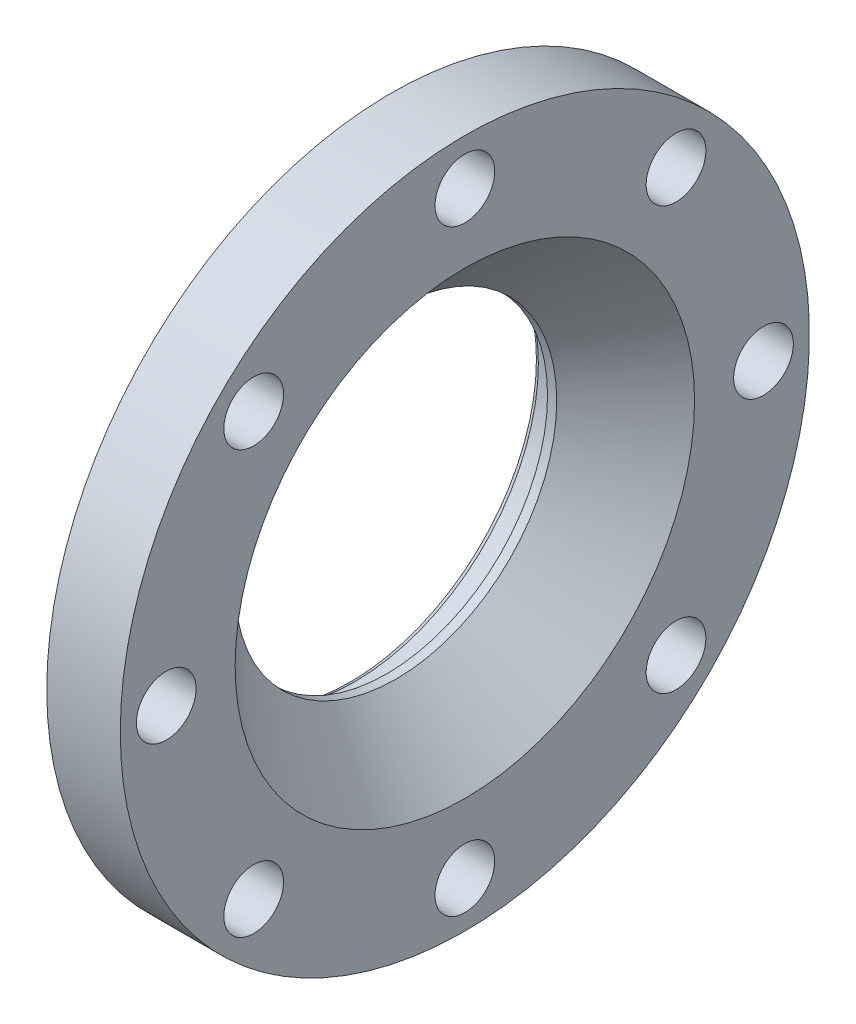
SolidWorks part; units mm, degrees
ref_plane "Plan de face" through (0, 0, 0) normal (0, 0, 1) x (1, 0, 0)
ref_plane "Plan de dessus" through (0, 0, 0) normal (0, 1, 0) x (1, 0, 0)
ref_plane "Plan de droite" through (0, 0, 0) normal (1, 0, 0) x (0, 0, -1)
sketch "Esquisse1" plane through (0, 0, 0) normal (0, 0, 1) x (1, 0, 0)
  line L0 (0, 0) -> (38.5331, 0) construction
  line L1 (0, 47.5) -> (0, 55)
  line L2 (0, 55) -> (3, 55)
  line L3 (3, 55) -> (3, 51.9)
  line L4 (3, 51.9) -> (7.8, 51.9)
  line L5 (7.8, 51.9) -> (7.8, 55)
  line L6 (7.8, 55) -> (12, 55)
  line L7 (12, 55) -> (12, 75)
  line L8 (12, 75) -> (28, 75)
  line L9 (28, 75) -> (28, 50)
  line L10 (28, 50) -> (13, 35)
  line L11 (13, 35) -> (11, 35)
  line L12 (11, 35) -> (11, 40)
  line L13 (11, 40) -> (3, 40)
  line L14 (3, 40) -> (3, 47.5)
  line L15 (3, 47.5) -> (0, 47.5)
  dimension "D1" = 150
  dimension "D2" = 45
  dimension "D3" = 28
  dimension "D4" = 12
  dimension "D5" = 3
  dimension "D6" = 4.8
  dimension "D7" = 3
  dimension "D8" = 8
  dimension "D9" = 35
  dimension "D10" = 40
  dimension "D11" = 47.5
  dimension "D12" = 55
  dimension "D13" = 51.9
  dimension "D14" = 50
revolve "Révolution1" add sketch "Esquisse1" angle 360 about L0
sketch "Esquisse2" plane through (28, 0, 0) normal (1, 0, 0) x (0, 0, -1)
  line L0 (0, 0) -> (0, 65) construction
  circle A0 centre (0, 65) radius 6.5
  circle A1 centre (45.9619, 45.9619) radius 6.5
  circle A2 centre (65, 0) radius 6.5
  circle A3 centre (45.9619, -45.9619) radius 6.5
  circle A4 centre (0, -65) radius 6.5
  circle A5 centre (-45.9619, -45.9619) radius 6.5
  circle A6 centre (-65, 0) radius 6.5
  circle A7 centre (-45.9619, 45.9619) radius 6.5
  dimension "D2" = 13
  dimension "D1" = 65
extrude "Enlèv. mat.-Extru.1" cut sketch "Esquisse2" against normal through all
chamfer "Chanfrein1" distance 1 angle 30 1 edges at (3, 0, 40)
